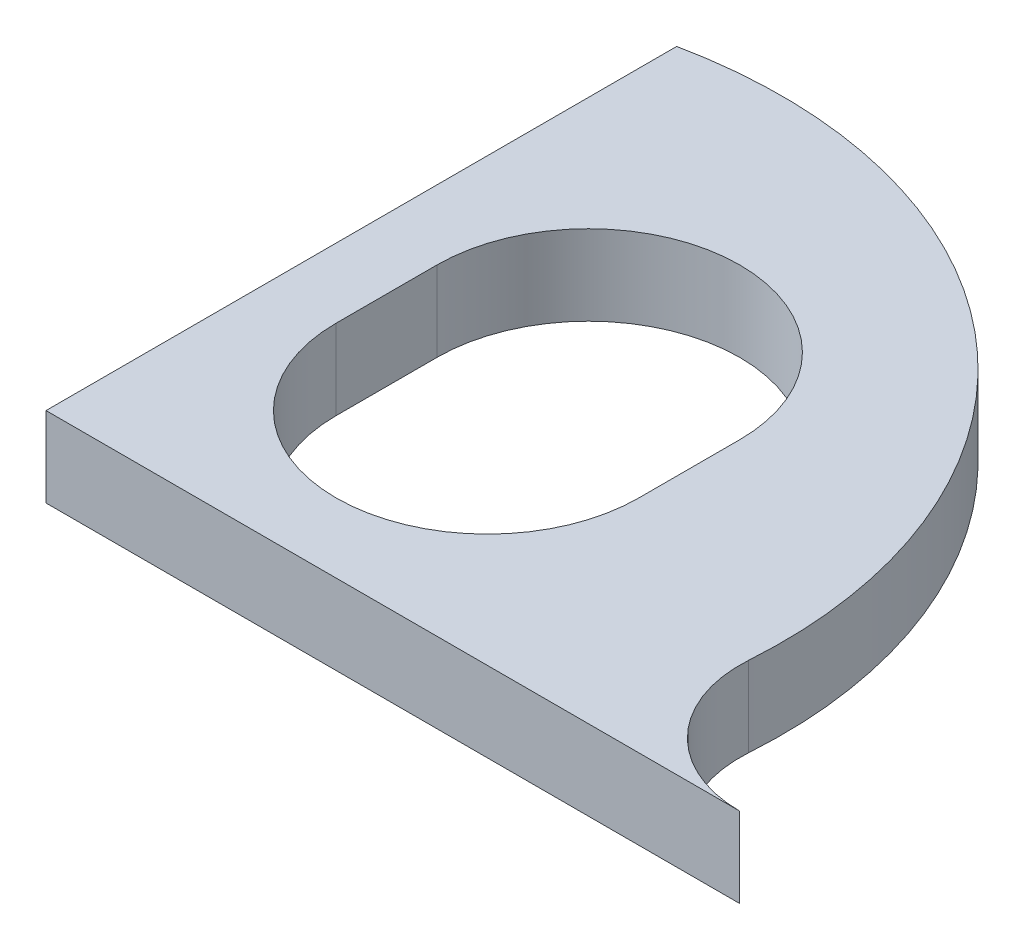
SolidWorks part; units mm, degrees
ref_plane "Front Plane" through (0, 0, 0) normal (0, 0, 1) x (1, 0, 0)
ref_plane "Top Plane" through (0, 0, 0) normal (0, 1, 0) x (1, 0, 0)
ref_plane "Right Plane" through (0, 0, 0) normal (1, 0, 0) x (0, 0, -1)
sketch "Sketch1" plane through (0, 0, 0) normal (0, 1, 0) x (1, 0, 0)
  line L0 (0, 0) -> (45, 0)
  line L1 (0, 0) -> (0, 50)
  line L2 (17.5, 17.5) -> (17.5, 25.5) construction
  line L3 (5.5, 17.5) -> (5.5, 25.5)
  line L4 (29.5, 17.5) -> (29.5, 25.5)
  line L6 (45, 0) -> (55, 0)
  arc A1 (5.5, 17.5) -> (29.5, 17.5) centre (17.5, 17.5) ccw
  arc A2 (29.5, 25.5) -> (5.5, 25.5) centre (17.5, 25.5) ccw
  arc A3 (45, 10.7094) -> (55, 0) centre (55, 10.0235) ccw
  arc A4 (45, 10.7094) -> (0, 50) centre (7.5879, 13.2757) ccw
  point P6 (17.5, 21.5)
  dimension "D1" = 50
  dimension "D3" = 12
  dimension "D4" = 17.5
  dimension "D8" = 75
  dimension "D2" = 45
  dimension "D5" = 8
  dimension "D6" = 17.5
  dimension "D7" = 10
extrude "Boss-Extrude1" add sketch "Sketch1" along normal blind 6.35
